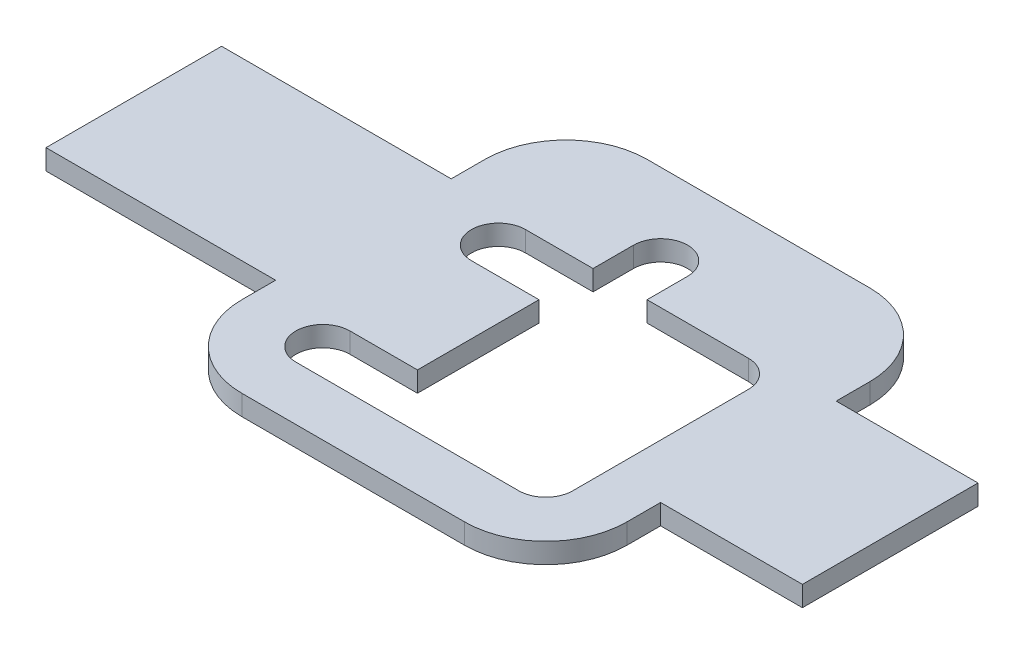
SolidWorks part; units mm, degrees
ref_plane "Front Plane" through (0, 0, 0) normal (0, 0, 1) x (1, 0, 0)
ref_plane "Top Plane" through (0, 0, 0) normal (0, 1, 0) x (1, 0, 0)
ref_plane "Right Plane" through (0, 0, 0) normal (1, 0, 0) x (0, 0, -1)
sketch "Sketch1" plane through (0, 0, 0) normal (0, 1, 0) x (1, 0, 0)
  line L0 (0, 0) -> (34, 0)
  line L1 (34, 0) -> (34, -5)
  line L2 (46, -17) -> (79, -17)
  line L3 (91, -5) -> (91, 0)
  line L4 (91, 0) -> (112, 0)
  line L5 (112, 0) -> (112, 26)
  line L6 (112, 26) -> (91, 26)
  line L7 (91, 26) -> (91, 31)
  line L8 (79, 43) -> (46, 43)
  line L9 (34, 31) -> (34, 26)
  line L10 (34, 26) -> (0, 26)
  line L11 (0, 26) -> (0, 0)
  line L12 (83, -5) -> (83, 21)
  line L13 (64, 31) -> (64, 25)
  line L14 (56, 31) -> (56, 25)
  line L15 (79, 25) -> (64, 25)
  line L16 (46, -9) -> (79, -9)
  line L17 (46, -1) -> (56, -1)
  line L18 (46, 17) -> (56, 17)
  line L19 (56, 17) -> (56, -1)
  line L20 (56, 25) -> (46, 25)
  arc A0 (34, 31) -> (46, 43) centre (46, 31) cw
  arc A1 (91, 31) -> (79, 43) centre (79, 31) ccw
  arc A2 (79, -17) -> (91, -5) centre (79, -5) ccw
  arc A3 (46, -17) -> (34, -5) centre (46, -5) cw
  arc A4 (64, 31) -> (56, 31) centre (60, 31) ccw
  arc A5 (46, 25) -> (46, 17) centre (46, 21) ccw
  arc A6 (46, -1) -> (46, -9) centre (46, -5) ccw
  arc A7 (79, -9) -> (83, -5) centre (79, -5) ccw
  arc A8 (83, 21) -> (79, 25) centre (79, 21) ccw
  point P19 (91, -17)
  point P22 (34, -17)
  dimension "D10" = 12
  dimension "D11" = 8
  dimension "D1" = 112
  dimension "D2" = 60
  dimension "D3" = 34
  dimension "D4" = 57
  dimension "D5" = 57
  dimension "D6" = 34
  dimension "D7" = 26
  dimension "D8" = 26
  dimension "D9" = 17
  dimension "D12" = 18
  dimension "D13" = 26
  dimension "D14" = 18
  dimension "D15" = 10
  dimension "D16" = 12
  dimension "D17" = 14
  dimension "D18" = 8
  dimension "D19" = 10
extrude "Extrude1" add sketch "Sketch1" along normal blind 3
